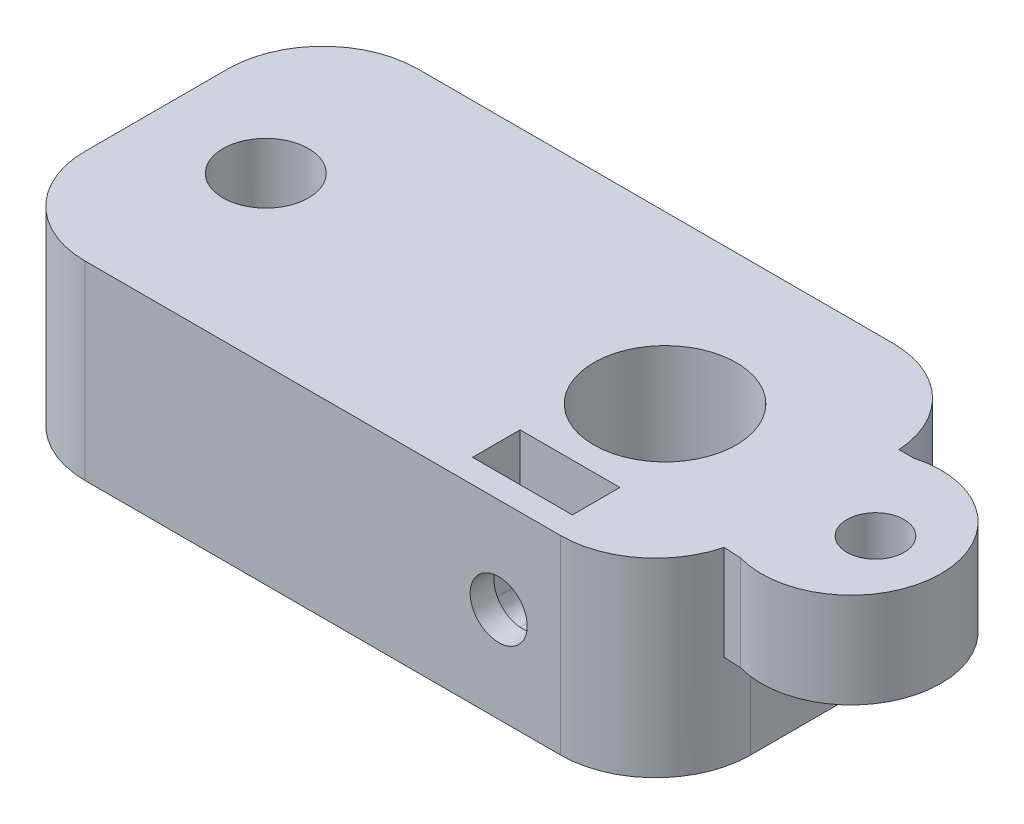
SolidWorks part; units mm, degrees
ref_plane "Alzado" through (0, 0, 0) normal (0, 0, 1) x (1, 0, 0)
ref_plane "Planta" through (0, 0, 0) normal (0, 1, 0) x (1, 0, 0)
ref_plane "Vista lateral" through (0, 0, 0) normal (1, 0, 0) x (0, 0, -1)
sketch "Croquis1" plane through (0, 0, 0) normal (0, 1, 0) x (1, 0, 0)
  line L0 (-45.8853, 48) -> (-45.8853, 30.5) construction
  line L1 (-29.3853, 30.5) -> (-99.3853, 30.5)
  line L2 (-29.3853, 30.5) -> (-29.3853, 65.5)
  line L3 (-29.3853, 65.5) -> (-99.3853, 65.5)
  line L4 (-99.3853, 30.5) -> (-99.3853, 65.5)
  line L5 (-45.8853, 48) -> (-45.8853, 65.5) construction
  circle A0 centre (-45.8853, 48) radius 7.5
  circle A1 centre (-45.8853, 48) radius 7.5 construction
  dimension "D1" = 35
  dimension "D2" = 70
  dimension "D3" = 16.5
extrude "Saliente-Extruir1" add sketch "Croquis1" along normal blind 20
sketch "Croquis2" plane through (-99.3853, 0, 0) normal (-1, 0, 0) x (0, 0, 1)
  line L0 (-54.5, 10) -> (-65.5, 10) construction
  line L1 (-54.5, 13) -> (-41.5, 13)
  line L2 (-54.5, 13) -> (-54.5, 7)
  line L3 (-54.5, 7) -> (-41.5, 7)
  line L4 (-41.5, 13) -> (-41.5, 7)
  line L5 (-65.5, 20) -> (-65.5, 0) construction
  line L6 (-41.5, 10) -> (-30.5, 10) construction
  line L7 (-30.5, 20) -> (-30.5, 0) construction
  line L8 (-48, 13) -> (-48, 20) construction
  line L9 (-65.5, 20) -> (-30.5, 20) construction
  line L10 (-48, 7) -> (-48, 0) construction
  line L11 (-65.5, 0) -> (-30.5, 0) construction
  dimension "D1" = 6
  dimension "D2" = 13
extrude "Cortar-Extruir1" cut sketch "Croquis2" against normal blind 14
sketch "Croquis3" plane through (0, 20, 0) normal (0, 1, 0) x (1, 0, 0)
  line L0 (-87.8853, 48) -> (-99.3853, 48) construction
  line L1 (-99.3853, 65.5) -> (-99.3853, 30.5) construction
  circle A0 centre (-87.8853, 48) radius 4.5
  circle A1 centre (-87.8853, 48) radius 12.5 construction
  dimension "D1" = 9
extrude "Cortar-Extruir2" cut sketch "Croquis3" against normal blind 27
fillet "Redondeo1" radius 10 4 edges at (-99.3853, 10, -65.5) (-99.3853, 10, -30.5) (-29.3853, 10, -65.5) (-29.3853, 10, -30.5)
sketch "Croquis4" plane through (0, 0, -30.5) normal (0, 0, 1) x (1, 0, 0)
  line L0 (-45.8853, 10) -> (-45.8853, 20) construction
  line L1 (-89.3853, 20) -> (-39.3853, 20) construction
  line L2 (-38.3853, 20) -> (-53.3853, 20) construction
  line L3 (-89.3853, 0) -> (-39.3853, 0) construction
  circle A0 centre (-45.8853, 10) radius 3
  point P7 (0, 0)
  dimension "D1" = 6
  dimension "D2" = 10
extrude "Cortar-Extruir3" cut sketch "Croquis4" against normal up to surface (10.6261 mm away)
sketch "Croquis5" plane through (0, 20, 0) normal (0, 1, 0) x (1, 0, 0)
  line L0 (-45.8853, 38) -> (-45.8853, 40.5) construction
  line L1 (-51.1353, 38) -> (-40.6353, 38)
  line L2 (-51.1353, 38) -> (-51.1353, 33)
  line L3 (-51.1353, 33) -> (-40.6353, 33)
  line L4 (-40.6353, 38) -> (-40.6353, 33)
  line L5 (-45.8853, 48) -> (-45.8853, 40.5) construction
  circle A0 centre (-45.8853, 48) radius 7.5 construction
  point P4 (-40.6353, 35.5)
  dimension "D1" = 10.5
  dimension "D2" = 7.5
  dimension "D3" = 5
extrude "Cortar-Extruir4" cut sketch "Croquis5" against normal blind 16
fillet "Redondeo2" radius 2 2 edges at (-40.6353, 4, -35.5) (-51.1353, 4, -35.5)
sketch "Croquis6" plane through (0, 20, 0) normal (0, 1, 0) x (1, 0, 0)
  line L0 (-27.8853, 37.9264) -> (-29.6976, 38.0207)
  line L1 (-27.8853, 56.124) -> (-29.4048, 56.124)
  line L2 (-29.3853, 40.5) -> (-29.3853, 55.5) construction
  line L3 (-29.3853, 40.5) -> (-29.3853, 55.5)
  circle A0 centre (-22.7756, 47.0252) radius 3 construction
  arc A1 (-27.8853, 37.9264) -> (-27.8853, 56.124) centre (-25.3387, 47.0252) ccw construction
  circle A2 centre (-22.7756, 47.0252) radius 3
  arc A3 (-27.8853, 37.9264) -> (-27.8853, 56.124) centre (-25.3387, 47.0252) ccw
  arc A4 (-39.3853, 30.5) -> (-29.3853, 40.5) centre (-39.3853, 40.5) ccw construction
  arc A7 (-29.3853, 55.5) -> (-39.3853, 65.5) centre (-39.3853, 55.5) ccw construction
  arc A8 (-29.3853, 55.5) -> (-29.4048, 56.124) centre (-39.3853, 55.5) ccw
  arc A9 (-29.6976, 38.0207) -> (-29.3853, 40.5) centre (-39.3853, 40.5) ccw
extrude "Saliente-Extruir2" add sketch "Croquis6" against normal blind 10
